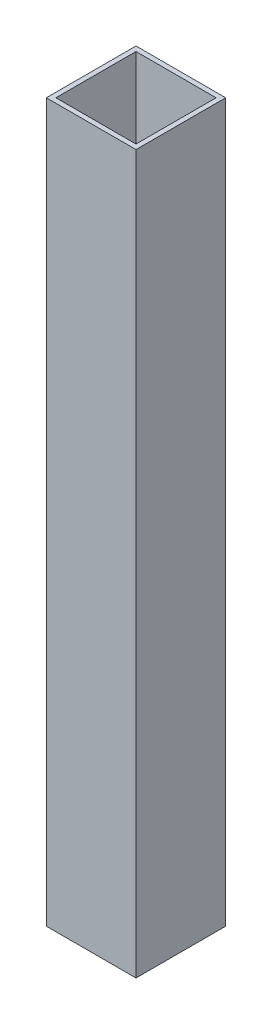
SolidWorks part; units mm, degrees
ref_plane "Front Plane" through (0, 0, 0) normal (0, 0, 1) x (1, 0, 0)
ref_plane "Top Plane" through (0, 0, 0) normal (0, 1, 0) x (1, 0, 0)
ref_plane "Right Plane" through (0, 0, 0) normal (1, 0, 0) x (0, 0, -1)
sketch "Sketch1" plane through (0, 0, 0) normal (0, 1, 0) x (1, 0, 0)
  line L1 (-34.036, -34.036) -> (34.036, -34.036)
  line L2 (-34.036, -34.036) -> (-34.036, 34.036)
  line L3 (-34.036, 34.036) -> (34.036, 34.036)
  line L4 (34.036, -34.036) -> (34.036, 34.036)
  line L5 (-34.036, -34.036) -> (34.036, 34.036) construction
  line L6 (-34.036, 34.036) -> (34.036, -34.036) construction
  line L7 (-38.1, -38.1) -> (38.1, -38.1)
  line L8 (-38.1, -38.1) -> (-38.1, 38.1)
  line L9 (-38.1, 38.1) -> (38.1, 38.1)
  line L10 (38.1, -38.1) -> (38.1, 38.1)
  line L11 (-38.1, -38.1) -> (38.1, 38.1) construction
  line L12 (-38.1, 38.1) -> (38.1, -38.1) construction
  point P0 (0, 0)
  point P6 (0, 0)
  dimension "D1" = 76.2
  dimension "D2" = 4.064
extrude "Boss-Extrude1" add sketch "Sketch1" along normal blind 609.6
